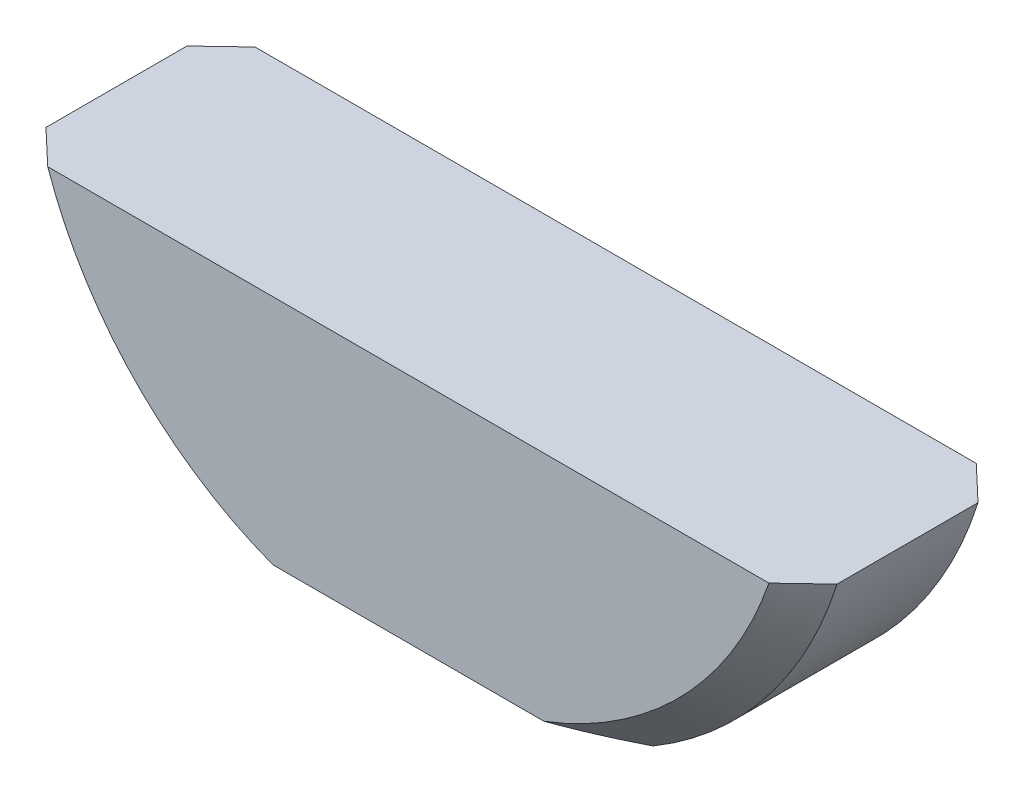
SolidWorks part; units mm, degrees
ref_plane "Front" through (0, 0, 0) normal (0, 0, 1) x (1, 0, 0)
ref_plane "Top" through (0, 0, 0) normal (0, 1, 0) x (1, 0, 0)
ref_plane "Right" through (0, 0, 0) normal (1, 0, 0) x (0, 0, -1)
sketch "Sketch1" plane through (0, 0, 0) normal (0, 0, 1) x (1, 0, 0)
  line L0 (-1.9079, 0) -> (1.9079, 0)
  arc A0 (-1.9079, 0) -> (1.9079, 0) centre (0, 0.6) ccw
  dimension "D" = 4
  dimension "h1" = 1.4
extrude "Extrude1" add sketch "Sketch1" along normal blind 1
sketch "Sketch2" plane through (0, 0, 0) normal (0, 0, 1) x (1, 0, 0)
  line L0 (-1.9079, -1.12) -> (1.9079, -1.12)
  line L1 (1.9079, 0) -> (-1.9079, 0) construction
  dimension "h2" = 1.12
extrude "Cut-Extrude1" cut sketch "Sketch2" against normal through all and the other way through all flip side to cut
chamfer "Chamfer1" distance 0.16 angle 45 4 edges at (1.5677, -0.6419, 0) (-1.5677, -0.6419, 0) (1.5677, -0.6419, 1) (-1.5677, -0.6419, 1)
equation "\"h2@Sketch2\" = 0.8 * \"h1@Sketch1\""
